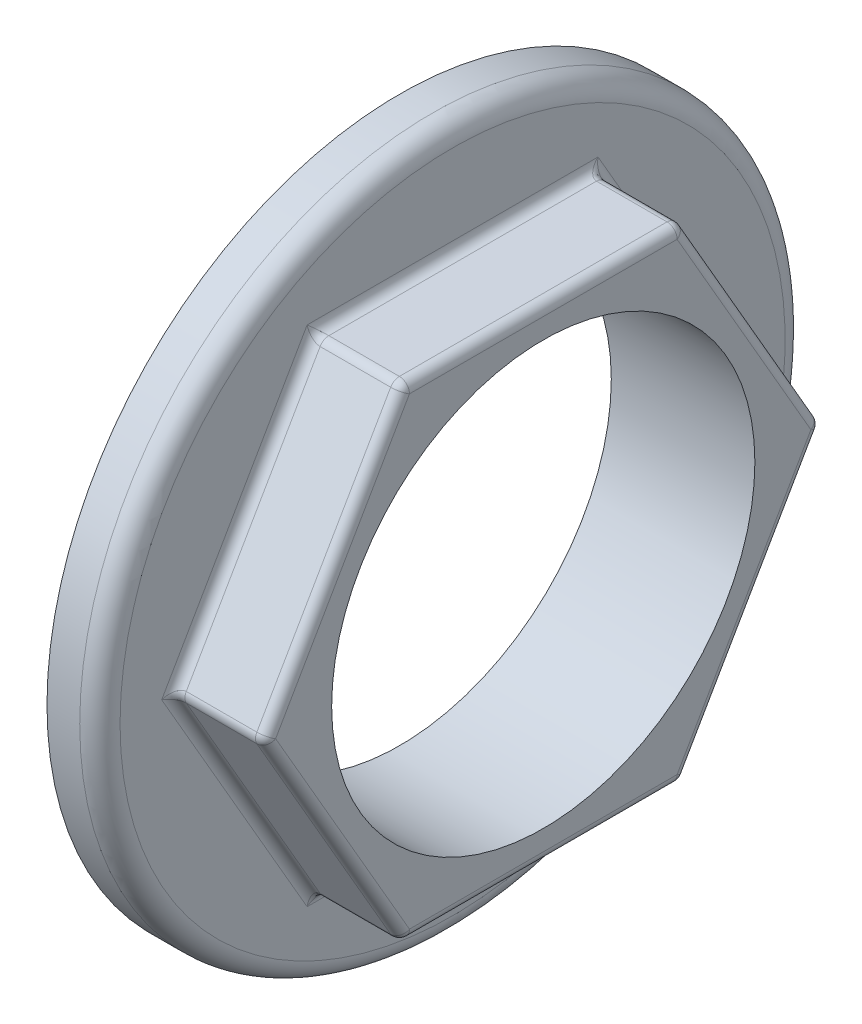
SolidWorks part; units mm, degrees
ref_plane "Face" through (0, 0, 0) normal (0, 0, 1) x (1, 0, 0)
ref_plane "Dessus" through (0, 0, 0) normal (0, 1, 0) x (1, 0, 0)
ref_plane "Droite" through (0, 0, 0) normal (1, 0, 0) x (0, 0, -1)
sketch "Esquisse1" plane through (0, 0, 0) normal (0, 0, 1) x (1, 0, 0)
  line L0 (-8.8418, 0) -> (83.9968, 0) construction
  line L1 (0, 21) -> (0, 35)
  line L2 (0, 35) -> (3.25, 35)
  line L3 (5.25, 33) -> (5.25, 21)
  line L4 (5.25, 21) -> (0, 21)
  arc A0 (5.25, 33) -> (3.25, 35) centre (3.25, 33) ccw
  dimension "D1" = 2
  dimension "D2" = 5.25
  dimension "D3" = 42
  dimension "D4" = 70
revolve "Révolution1" add sketch "Esquisse1" angle 360 about L0
sketch "Esquisse2" plane through (5.25, 0, 0) normal (1, 0, 0) x (0, 0, -1)
  line L1 (27.7128, 0) -> (13.8564, 24)
  line L2 (13.8564, 24) -> (-13.8564, 24)
  line L3 (-13.8564, 24) -> (-27.7128, 0)
  line L4 (-27.7128, 0) -> (-13.8564, -24)
  line L5 (-13.8564, -24) -> (13.8564, -24)
  line L6 (13.8564, -24) -> (27.7128, 0)
  circle A0 centre (0, 0) radius 24 construction
  circle A1 centre (0, 0) radius 21
  dimension "D1" = 24
extrude "Extrusion1" add sketch "Esquisse2" along normal blind 9
fillet "Congé1" radius 1
fillet "Congé2" radius 1
